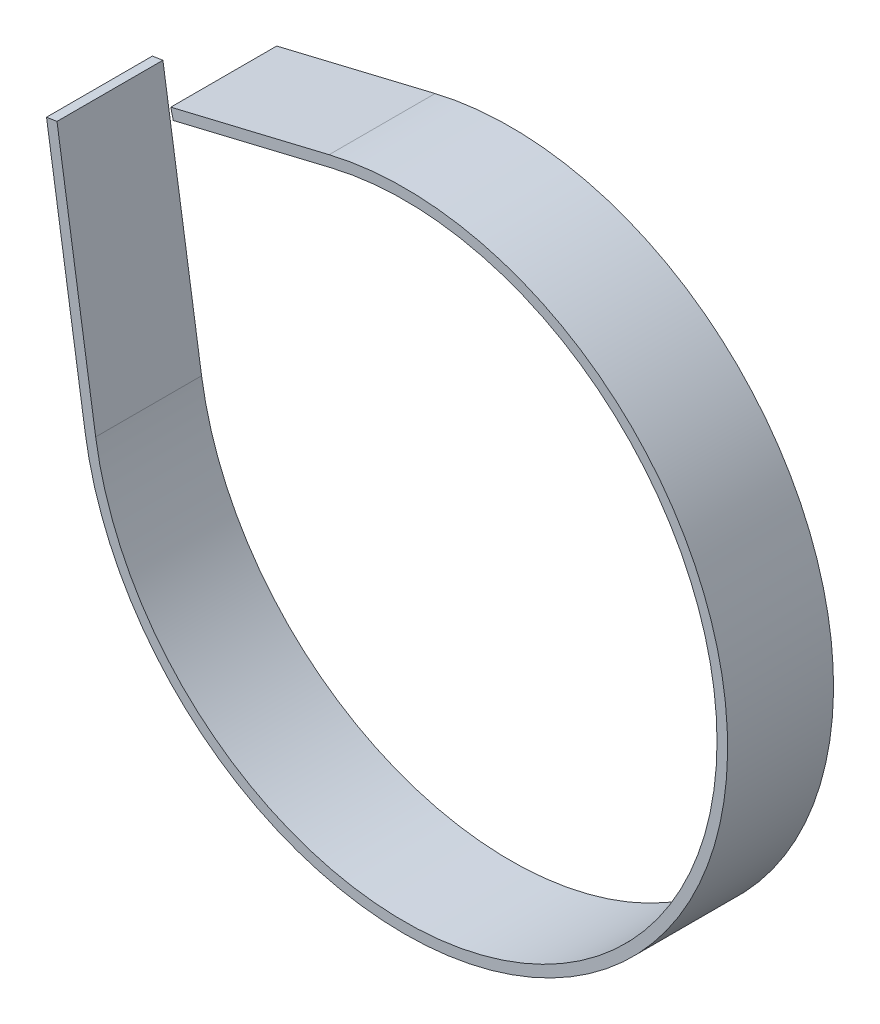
SolidWorks part; units mm, degrees
ref_plane "Plan de face" through (0, 0, 0) normal (0, 0, 1) x (1, 0, 0)
ref_plane "Plan de dessus" through (0, 0, 0) normal (0, 1, 0) x (1, 0, 0)
ref_plane "Plan de droite" through (0, 0, 0) normal (1, 0, 0) x (0, 0, -1)
sketch "Esquisse1" plane through (0, 0, 0) normal (0, 0, 1) x (1, 0, 0)
  line L0 (0, 0) -> (-70.2863, 292.7635) construction
  line L1 (0, 0) -> (-355.905, -54.2069) construction
  line L2 (0, 0) -> (0, 181.2087) construction
  line L3 (-233.3094, -35.5347) -> (-262.5201, 156.2536)
  line L4 (-241.2182, -36.7392) -> (-270.4289, 155.049)
  line L5 (-270.4289, 155.049) -> (-262.5201, 156.2536)
  line L6 (-55.0931, 229.4793) -> (-174.6946, 200.7655)
  line L7 (-56.9607, 237.2583) -> (-176.5622, 208.5445)
  line L8 (-176.5622, 208.5445) -> (-174.6946, 200.7655)
  arc A0 (-233.3094, -35.5347) -> (-55.0931, 229.4793) centre (0, 0) ccw
  arc A1 (-241.2182, -36.7392) -> (-56.9607, 237.2583) centre (0, 0) ccw
  dimension "D3" = 236
  dimension "D4" = 244
  dimension "D1" = 13.5
  dimension "D2" = 98.66
  dimension "D5" = 194
  dimension "D6" = 123
extrude "Extrusion1" add sketch "Esquisse1" along normal blind 80
